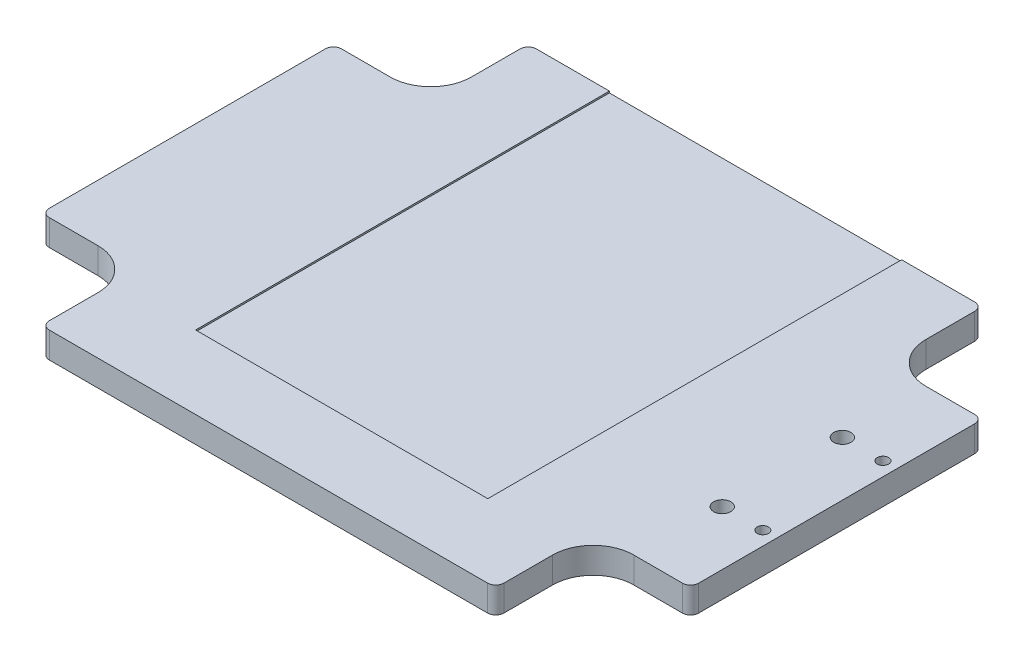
SolidWorks part; units mm, degrees
ref_plane "Front Plane" through (0, 0, 0) normal (0, 0, 1) x (1, 0, 0)
ref_plane "Top Plane" through (0, 0, 0) normal (0, 1, 0) x (1, 0, 0)
ref_plane "Right Plane" through (0, 0, 0) normal (1, 0, 0) x (0, 0, -1)
sketch "Sketch1" plane through (0, 0, 0) normal (0, 1, 0) x (1, 0, 0)
  line L0 (-19.5, 9) -> (-16.5, 9)
  line L1 (-16.5, -15) -> (16.5, -15) construction
  line L2 (-20, -11.5) -> (-20, 11.5) construction
  line L3 (-16.5, 15) -> (16.5, 15) construction
  line L4 (20, -11.5) -> (20, 11.5) construction
  line L5 (-20, -15) -> (20, 15) construction
  line L6 (-20, 15) -> (20, -15) construction
  line L7 (-14, 11.5) -> (-14, 14.5)
  line L8 (-13.5, 15) -> (13.5, 15)
  line L9 (14, 14.5) -> (14, 11.5)
  line L10 (16.5, 9) -> (19.5, 9)
  line L11 (20, 8.5) -> (20, -8.5)
  line L12 (19.5, -9) -> (16.5, -9)
  line L13 (14, -11.5) -> (14, -14.5)
  line L14 (13.5, -15) -> (-13.5, -15)
  line L15 (-14, -14.5) -> (-14, -11.5)
  line L16 (-16.5, -9) -> (-19.5, -9)
  line L17 (-20, -8.5) -> (-20, 8.5)
  circle A0 centre (-16.5, 11.5) radius 1 construction
  circle A1 centre (-16.5, -11.5) radius 1 construction
  circle A2 centre (16.5, -11.5) radius 1 construction
  circle A3 centre (16.5, 11.5) radius 1 construction
  arc A4 (16.5, 15) -> (20, 11.5) centre (16.5, 11.5) cw construction
  arc A5 (16.5, -15) -> (20, -11.5) centre (16.5, -11.5) ccw construction
  arc A6 (-16.5, -15) -> (-20, -11.5) centre (-16.5, -11.5) cw construction
  arc A7 (-20, 11.5) -> (-16.5, 15) centre (-16.5, 11.5) cw construction
  circle A8 centre (16.65, 3.7) radius 0.53
  circle A9 centre (16.65, -3.7) radius 0.53
  circle A10 centre (19.15, -3.7) radius 0.35
  circle A11 centre (19.15, 3.7) radius 0.35
  arc A12 (14, 11.5) -> (16.5, 9) centre (16.5, 11.5) ccw
  arc A13 (16.5, -9) -> (14, -11.5) centre (16.5, -11.5) ccw
  arc A14 (-14, -11.5) -> (-16.5, -9) centre (-16.5, -11.5) ccw
  arc A15 (-16.5, 9) -> (-14, 11.5) centre (-16.5, 11.5) ccw
  arc A16 (13.5, 15) -> (14, 14.5) centre (13.5, 14.5) cw
  arc A17 (19.5, 9) -> (20, 8.5) centre (19.5, 8.5) cw
  arc A18 (20, -8.5) -> (19.5, -9) centre (19.5, -8.5) cw
  arc A19 (14, -14.5) -> (13.5, -15) centre (13.5, -14.5) cw
  arc A20 (-13.5, -15) -> (-14, -14.5) centre (-13.5, -14.5) cw
  arc A21 (-19.5, -9) -> (-20, -8.5) centre (-19.5, -8.5) cw
  arc A22 (-19.5, 9) -> (-20, 8.5) centre (-19.5, 8.5) ccw
  arc A23 (-14, 14.5) -> (-13.5, 15) centre (-13.5, 14.5) cw
  point P0 (0, 0)
  point P56 (14, 15)
  point P59 (20, 9)
  point P62 (20, -9)
  point P65 (14, -15)
  point P68 (-14, -15)
  point P71 (-20, -9)
  point P74 (-20, 9)
  point P77 (-14, 15)
  dimension "D3" = 2
  dimension "D8" = 3.5
  dimension "D15" = 0.7
  dimension "D16" = 1.06
  dimension "D18" = 2.5
  dimension "D19" = 0.5
  dimension "D1" = 40
  dimension "D2" = 30
  dimension "D4" = 3.5
  dimension "D5" = 3.5
  dimension "D6" = 3.5
  dimension "D7" = 3.5
  dimension "D9" = 36.65
  dimension "D10" = 11.3
  dimension "D11" = 7.4
  dimension "D12" = 39.15
  dimension "D13" = 18.7
  dimension "D14" = 11.3
  dimension "D17" = 6
extrude "Boss-Extrude1" add sketch "Sketch1" along normal blind 1.6
sketch "Sketch2" plane through (0, 1.6, 0) normal (0, 1, 0) x (1, 0, 0)
  line L1 (-9, -10.49) -> (9, -10.49)
  line L2 (-9, -10.49) -> (-9, 15)
  line L3 (-9, 15) -> (9, 15)
  line L4 (9, -10.49) -> (9, 15)
  line L5 (13.5, 15) -> (-13.5, 15) construction
  point P6 (0, -10.49)
  dimension "D1" = 18
  dimension "D2" = 25.49
extrude "Cut-Extrude1" cut sketch "Sketch2" against normal blind 0.1
sketch "Sketch3" plane through (0, 0, 0) normal (0, -1, 0) x (1, 0, 0)
  line L1 (-19.5, -6) -> (-14.9, -6)
  line L2 (-19.5, -6) -> (-19.5, -5)
  line L3 (-19.5, -5) -> (-14.9, -5)
  line L4 (-14.9, -6) -> (-14.9, -5)
  line L5 (-19.5, -4) -> (-14.9, -4)
  line L6 (-19.5, -4) -> (-19.5, -3)
  line L7 (-19.5, -3) -> (-14.9, -3)
  line L8 (-14.9, -4) -> (-14.9, -3)
  line L9 (-13.7, -7.1) -> (-10.3, -7.1)
  line L10 (-13.7, -7.1) -> (-13.7, -8.7)
  line L11 (-13.7, -8.7) -> (-10.3, -8.7)
  line L12 (-10.3, -7.1) -> (-10.3, -8.7)
  line L13 (-13.7, -1.9) -> (-10.3, -1.9)
  line L14 (-13.7, -1.9) -> (-13.7, -0.3)
  line L15 (-13.7, -0.3) -> (-10.3, -0.3)
  line L16 (-10.3, -1.9) -> (-10.3, -0.3)
  line L18 (-19.5, 3) -> (-14.9, 3)
  line L19 (-19.5, 3) -> (-19.5, 4)
  line L20 (-19.5, 4) -> (-14.9, 4)
  line L21 (-14.9, 3) -> (-14.9, 4)
  line L22 (-19.5, 5) -> (-14.9, 5)
  line L23 (-19.5, 5) -> (-19.5, 6)
  line L24 (-19.5, 6) -> (-14.9, 6)
  line L25 (-14.9, 5) -> (-14.9, 6)
  line L26 (-13.7, 1.9) -> (-10.3, 1.9)
  line L27 (-13.7, 1.9) -> (-13.7, 0.3)
  line L28 (-13.7, 0.3) -> (-10.3, 0.3)
  line L29 (-10.3, 1.9) -> (-10.3, 0.3)
  line L30 (-13.7, 7.1) -> (-10.3, 7.1)
  line L31 (-13.7, 7.1) -> (-13.7, 8.7)
  line L32 (-13.7, 8.7) -> (-10.3, 8.7)
  line L33 (-10.3, 7.1) -> (-10.3, 8.7)
  line L34 (-9.3, 9.25) -> (-9.3, 10.6)
  line L35 (-8.3, 9.25) -> (-8.3, 10.6)
  line L36 (-8.3, 9.25) -> (-8.9, 9.25)
  line L37 (-8.9, 9.25) -> (-8.9, 10.6)
  line L38 (-8.3, 10.6) -> (-8.9, 10.6)
  line L39 (-6.7, 12.6) -> (-6.7, 14.6)
  line L40 (-6.7, 12.6) -> (-7.9, 12.6)
  line L41 (-7.9, 12.6) -> (-7.9, 14.6)
  line L42 (-6.7, 14.6) -> (-7.9, 14.6)
  line L43 (-9.3, 9.25) -> (-9.9, 9.25)
  line L44 (-9.9, 9.25) -> (-9.9, 10.6)
  line L45 (-9.3, 10.6) -> (-9.9, 10.6)
  line L50 (-10.3, 9.25) -> (-10.3, 10.6)
  line L51 (-10.3, 9.25) -> (-10.9, 9.25)
  line L52 (-10.9, 9.25) -> (-10.9, 10.6)
  line L53 (-10.3, 10.6) -> (-10.9, 10.6)
  line L54 (-11.3, 9.25) -> (-11.3, 10.6)
  line L55 (-11.3, 9.25) -> (-11.9, 9.25)
  line L56 (-11.9, 9.25) -> (-11.9, 10.6)
  line L57 (-11.3, 10.6) -> (-11.9, 10.6)
  line L58 (-12.3, 12.6) -> (-12.3, 14.6)
  line L59 (-12.3, 12.6) -> (-13.5, 12.6)
  line L60 (-13.5, 12.6) -> (-13.5, 14.6)
  line L61 (-12.3, 14.6) -> (-13.5, 14.6)
  line L62 (-9, -15) -> (-13.5, -15) construction
  line L64 (-20, -8.5) -> (-20, 8.5) construction
  dimension "D1" = 4.6
  dimension "D2" = 1
  dimension "D3" = 3.4
  dimension "D4" = 1.6
  dimension "D5" = 9
  dimension "D6" = 0.5
  dimension "D7" = 1
  dimension "D8" = 1.2
  dimension "D9" = 1.1
  dimension "D10" = 5.2
  dimension "D11" = 4.6
  dimension "D12" = 1
  dimension "D13" = 3.4
  dimension "D14" = 1.6
  dimension "D15" = 1
  dimension "D16" = 1.2
  dimension "D17" = 1.1
  dimension "D18" = 5.2
  dimension "D19" = 18
  dimension "D20" = 0.4
  dimension "D21" = 0.4
  dimension "D22" = 0.4
  dimension "D23" = 1.35
  dimension "D24" = 0.6
  dimension "D25" = 2
  dimension "D26" = 1.2
  dimension "D27" = 2
  dimension "D28" = 0.4
  dimension "D29" = 4.4
  dimension "D30" = 6.5
  dimension "D31" = 29.6
extrude "Cut-Extrude2" cut sketch "Sketch3" against normal blind 0.1
